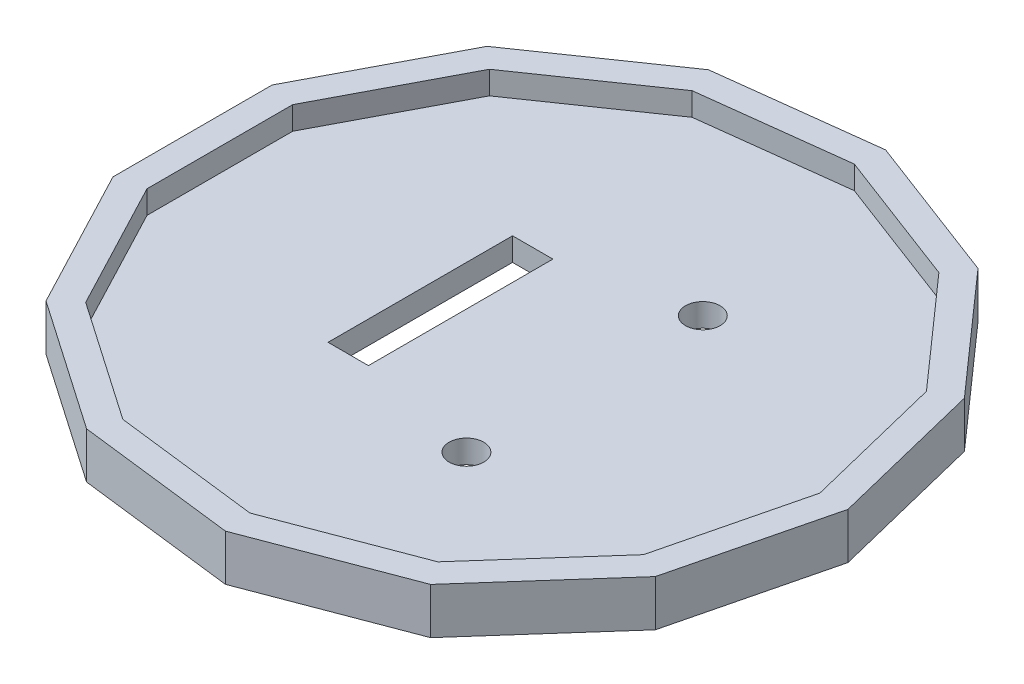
SolidWorks part; units mm, degrees
ref_plane "Front Plane" through (0, 0, 0) normal (0, 0, 1) x (1, 0, 0)
ref_plane "Top Plane" through (0, 0, 0) normal (0, 1, 0) x (1, 0, 0)
ref_plane "Right Plane" through (0, 0, 0) normal (1, 0, 0) x (0, 0, -1)
sketch "Sketch5" plane through (0, 0, 0) normal (0, 1, 0) x (1, 0, 0)
  line L36 (-21.5855, 19.1231) -> (-28, 6.9014)
  line L37 (27.8081, 0) -> (24.6228, 12.923) construction
  line L46 (24.6228, 12.923) -> (15.7968, 22.8856) construction
  line L50 (15.7968, 22.8856) -> (3.3519, 27.6053) construction
  line L51 (3.3519, 27.6053) -> (-9.8609, 26.001) construction
  line L52 (-9.8609, 26.001) -> (-20.8146, 18.4401) construction
  line L58 (-20.8146, 18.4401) -> (-27, 6.6549) construction
  line L59 (-26, -6.4084) -> (-20.0437, -17.7572) construction
  line L60 (-20.0437, -17.7572) -> (-9.4957, -25.038) construction
  line L61 (-9.4957, -25.038) -> (3.2277, -26.5829) construction
  line L62 (3.2277, -26.5829) -> (15.2117, -22.038) construction
  line L63 (-27, 6.6549) -> (-27, -6.6549) construction
  line L64 (-27, -6.6549) -> (-20.8146, -18.4401) construction
  line L65 (-20.8146, -18.4401) -> (-9.8609, -26.001) construction
  line L66 (-9.8609, -26.001) -> (3.3519, -27.6053) construction
  line L67 (3.3519, -27.6053) -> (15.7968, -22.8856) construction
  line L68 (15.7968, -22.8856) -> (24.6228, -12.923) construction
  line L69 (24.6228, -12.923) -> (27.8081, 0) construction
  line L70 (-28, 6.9014) -> (-28, -6.9014)
  line L71 (-28, -6.9014) -> (-21.5855, -19.1231)
  line L72 (-21.5855, -19.1231) -> (-10.2261, -26.964)
  line L73 (-10.2261, -26.964) -> (3.476, -28.6277)
  line L74 (3.476, -28.6277) -> (16.3818, -23.7332)
  line L75 (16.3818, -23.7332) -> (25.5348, -13.4017)
  line L76 (25.5348, -13.4017) -> (28.838, 0)
  line L77 (28.838, 0) -> (25.5348, 13.4017)
  line L78 (25.5348, 13.4017) -> (16.3818, 23.7332)
  line L79 (16.3818, 23.7332) -> (3.476, 28.6277)
  line L80 (3.476, 28.6277) -> (-10.2261, 26.964)
  line L81 (-10.2261, 26.964) -> (-21.5855, 19.1231)
  line L82 (15.2117, -22.038) -> (23.7109, -12.4444) construction
  line L83 (23.7109, -12.4444) -> (26.7781, 0) construction
  line L84 (26.7781, 0) -> (23.7109, 12.4444) construction
  line L85 (23.7109, 12.4444) -> (15.2117, 22.038) construction
  line L86 (15.2117, 22.038) -> (3.2277, 26.5829) construction
  line L87 (3.2277, 26.5829) -> (-9.4957, 25.038) construction
  line L88 (-9.4957, 25.038) -> (-20.0437, 17.7572) construction
  line L89 (-20.0437, 17.7572) -> (-26, 6.4084) construction
  line L90 (-26, 6.4084) -> (-26, -6.4084) construction
  circle A0 centre (0, 0) radius 27 construction
  dimension "D1" = 1
  dimension "D2" = 28
  dimension "D3" = 1
extrude "Sensor Block" add sketch "Sketch5" along normal blind 4
ref_plane "Plane1" through (0, 4, 0) normal (0, 1, 0) x (1, 0, 0)
sketch "Sketch7" plane through (0, 4, 0) normal (0, 1, 0) x (1, 0, 0)
  line L24 (26.4, 0) -> (23.376, 12.2687)
  line L25 (23.376, 12.2687) -> (14.9969, 21.7268)
  line L26 (14.9969, 21.7268) -> (3.1822, 26.2075)
  line L27 (3.1822, 26.2075) -> (-9.3616, 24.6844)
  line L28 (-9.3616, 24.6844) -> (-19.7607, 17.5064)
  line L29 (-19.7607, 17.5064) -> (-25.6329, 6.3179)
  line L30 (-25.6329, 6.3179) -> (-25.6329, -6.3179)
  line L31 (-25.6329, -6.3179) -> (-19.7607, -17.5064)
  line L32 (-19.7607, -17.5064) -> (-9.3616, -24.6844)
  line L33 (-9.3616, -24.6844) -> (3.1822, -26.2075)
  line L34 (3.1822, -26.2075) -> (14.9969, -21.7268)
  line L35 (14.9969, -21.7268) -> (23.376, -12.2687)
  line L36 (23.376, -12.2687) -> (26.4, 0)
  circle A0 centre (0, 0) radius 25.6329 construction
  dimension "D1" = 26.4
extrude "Sensor Base Cut" cut sketch "Sketch7" against normal blind 2
sketch "Sketch9" plane through (0, 0, 0) normal (0, 1, 0) x (1, 0, 0)
  line L0 (-2.2, 0) -> (2.2, 0) construction
  line L1 (-8.75, -13) -> (8.75, -13) construction
  line L2 (-8.75, -13) -> (-8.75, 13) construction
  line L3 (-8.75, 13) -> (8.75, 13) construction
  line L4 (8.75, -13) -> (8.75, 13) construction
  line L5 (-8.75, -13) -> (8.75, 13) construction
  line L6 (-8.75, 13) -> (8.75, -13) construction
  line L8 (-8.25, -8) -> (-4.75, -8)
  line L9 (-8.25, -8) -> (-8.25, 8)
  line L10 (-8.25, 8) -> (-4.75, 8)
  line L11 (-4.75, -8) -> (-4.75, 8)
  line L12 (-8.25, -8) -> (-4.75, 8) construction
  line L13 (-8.25, 8) -> (-4.75, -8) construction
  circle A0 centre (6, 10.25) radius 1.5
  circle A1 centre (6, -10.25) radius 1.5
  point P0 (0, 0)
  point P12 (-6.5, 0)
  dimension "D3" = 2.75
  dimension "D5" = 3
  dimension "D1" = 17.5
  dimension "D2" = 26
  dimension "D4" = 2.75
  dimension "D6" = 16
  dimension "D7" = 4
  dimension "D8" = 3.5
extrude "Sensor Holes" cut sketch "Sketch9" along normal blind 2
